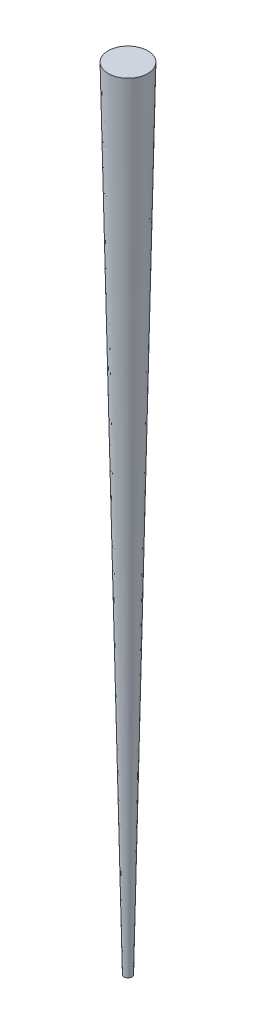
SolidWorks part; units mm, degrees
ref_plane "Front Plane" through (0, 0, 0) normal (0, 0, 1) x (1, 0, 0)
ref_plane "Top Plane" through (0, 0, 0) normal (0, 1, 0) x (1, 0, 0)
ref_plane "Right Plane" through (0, 0, 0) normal (1, 0, 0) x (0, 0, -1)
sketch "Sketch3" plane through (0, 0, 0) normal (0, 0, 1) x (1, 0, 0)
  line L3 (0, 0) -> (0, 100)
  line L4 (0, 100) -> (2.5, 100)
  line L5 (2.5, 100) -> (0.5, 0)
  line L6 (0.5, 0) -> (0, 0)
  dimension "D1" = 100
  dimension "D2" = 2.5
  dimension "D3" = 0.5
revolve "Revolve1" add sketch "Sketch3" angle 360 about L3
